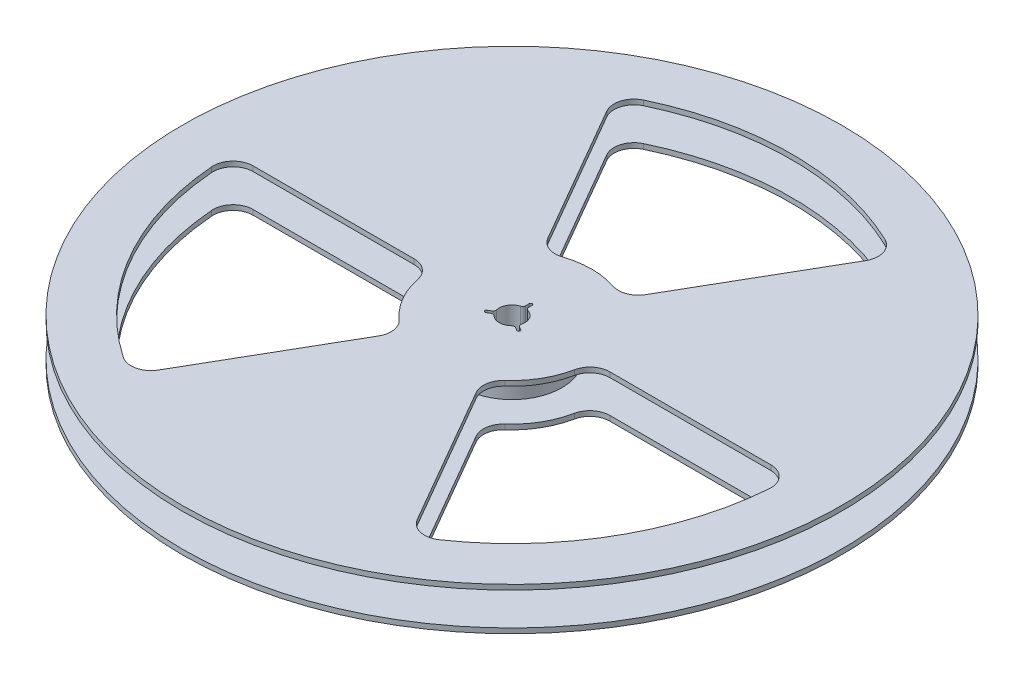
SolidWorks part; units mm, degrees
ref_plane "Front Plane" through (0, 0, 0) normal (0, 0, 1) x (1, 0, 0)
ref_plane "Top Plane" through (0, 0, 0) normal (0, 1, 0) x (1, 0, 0)
ref_plane "Right Plane" through (0, 0, 0) normal (1, 0, 0) x (0, 0, -1)
sketch "Sketch1" plane through (0, 0, 0) normal (0, 0, 1) x (1, 0, 0)
  line L2 (0, 8.2) -> (0, -8.2)
  line L4 (25, 8.2) -> (25, -8.2)
  line L5 (25, 8.2) -> (165, 8.2)
  line L6 (0, 8.2) -> (0, 10.7)
  line L7 (0, 10.7) -> (165, 10.7)
  line L8 (165, 8.2) -> (165, 10.7)
  line L9 (25, -8.2) -> (165, -8.2)
  line L10 (0, -8.2) -> (0, -10.7)
  line L11 (0, -10.7) -> (165, -10.7)
  line L12 (165, -8.2) -> (165, -10.7)
  dimension "D1" = 25
  dimension "D2" = 16.4
  dimension "D3" = 165
  dimension "D4" = 2.5
revolve "Revolve1" add sketch "Sketch1" angle 360 about L2
sketch "Sketch2" plane through (0, 10.7, 0) normal (0, 1, 0) x (1, 0, 0)
  line L0 (-0.75, 9.35) -> (-0.75, 7.5728)
  line L1 (0.75, 9.35) -> (0.75, 7.5728)
  line L2 (8.4723, -4.0255) -> (6.9332, -3.1369)
  line L3 (7.7223, -5.3245) -> (6.1832, -4.4359)
  line L4 (-7.7223, -5.3245) -> (-6.1832, -4.4359)
  line L5 (-8.4723, -4.0255) -> (-6.9332, -3.1369)
  arc A0 (-4.4016, -4.646) -> (4.4016, -4.646) centre (0, 0) ccw
  circle A1 centre (0, 0) radius 10.1 construction
  arc A2 (0.75, 9.35) -> (-0.75, 9.35) centre (0, 9.35) ccw
  arc A3 (7.7223, -5.3245) -> (8.4723, -4.0255) centre (8.0973, -4.675) ccw
  arc A4 (-8.4723, -4.0255) -> (-7.7223, -5.3245) centre (-8.0973, -4.675) ccw
  arc A5 (-1.8228, 6.1349) -> (-6.2244, -1.4889) centre (0, 0) ccw
  arc A6 (6.2244, -1.4889) -> (1.8228, 6.1349) centre (0, 0) ccw
  arc A7 (-6.1832, -4.4359) -> (-4.4016, -4.646) centre (-5.4332, -5.735) cw
  arc A8 (4.4016, -4.646) -> (6.1832, -4.4359) centre (5.4332, -5.735) cw
  arc A9 (6.9332, -3.1369) -> (6.2244, -1.4889) centre (7.6832, -1.8378) cw
  arc A10 (1.8228, 6.1349) -> (0.75, 7.5728) centre (2.25, 7.5728) cw
  arc A11 (-0.75, 7.5728) -> (-1.8228, 6.1349) centre (-2.25, 7.5728) cw
  arc A12 (-6.2244, -1.4889) -> (-6.9332, -3.1369) centre (-7.6832, -1.8378) cw
  point P21 (0, 0)
  point P29 (-0.75, 6.3559)
  dimension "D1" = 12.8
  dimension "D2" = 20.2
  dimension "D3" = 1.5
  dimension "D5" = 1.5
  dimension "D4" = 3
extrude "Cut-Extrude1" cut sketch "Sketch2" against normal through all contours A5 A12 L5 A4 L4 A7 A0 A8 L3 A3 L2 A9 A6 A10 L1 A2 L0 A11
sketch "Sketch3" plane through (0, 10.7, 0) normal (0, 1, 0) x (1, 0, 0)
  line L0 (48.9898, 0) -> (129.6148, 0)
  line L1 (24.4949, -42.4264) -> (64.8074, -112.2497)
  line L2 (0, 0) -> (0, -307.6345) construction
  line L3 (-48.9898, 0) -> (-129.6148, 0)
  line L4 (-24.4949, -42.4264) -> (-64.8074, -112.2497)
  line L5 (24.4949, 42.4264) -> (64.8074, 112.2497)
  line L6 (-24.4949, 42.4264) -> (-64.8074, 112.2497)
  arc A0 (79.119, -115.4997) -> (139.5852, -10.7692) centre (0, 0) ccw
  arc A1 (26.5241, -29.9411) -> (39.1918, -8) centre (0, 0) ccw
  arc A2 (139.5852, -10.7692) -> (129.6148, 0) centre (129.6148, -10) ccw
  arc A3 (24.4949, -42.4264) -> (26.5241, -29.9411) centre (33.1552, -37.4264) cw
  arc A4 (64.8074, -112.2497) -> (79.119, -115.4997) centre (73.4677, -107.2497) ccw
  arc A5 (48.9898, 0) -> (39.1918, -8) centre (48.9898, -10) ccw
  arc A6 (-39.1918, -8) -> (-26.5241, -29.9411) centre (0, 0) ccw
  arc A7 (-48.9898, 0) -> (-39.1918, -8) centre (-48.9898, -10) cw
  arc A8 (-129.6148, 0) -> (-139.5852, -10.7692) centre (-129.6148, -10) ccw
  arc A9 (-139.5852, -10.7692) -> (-79.119, -115.4997) centre (0, 0) ccw
  arc A10 (-79.119, -115.4997) -> (-64.8074, -112.2497) centre (-73.4677, -107.2497) ccw
  arc A11 (-24.4949, -42.4264) -> (-26.5241, -29.9411) centre (-33.1552, -37.4264) ccw
  arc A12 (12.6677, 37.9411) -> (-12.6677, 37.9411) centre (0, 0) ccw
  arc A13 (24.4949, 42.4264) -> (12.6677, 37.9411) centre (15.8346, 47.4264) cw
  arc A14 (64.8074, 112.2497) -> (60.4662, 126.2689) centre (56.1472, 117.2497) ccw
  arc A15 (60.4662, 126.2689) -> (-60.4662, 126.2689) centre (0, 0) ccw
  arc A16 (-60.4662, 126.2689) -> (-64.8074, 112.2497) centre (-56.1472, 117.2497) ccw
  arc A17 (-24.4949, 42.4264) -> (-12.6677, 37.9411) centre (-15.8346, 47.4264) ccw
  point P42 (0, 0)
  dimension "D1" = 280
  dimension "D2" = 80
  dimension "D4" = 10
  dimension "D5" = 10
  dimension "D3" = 60
  dimension "D6" = 3
extrude "Cut-Extrude2" cut sketch "Sketch3" against normal through all
